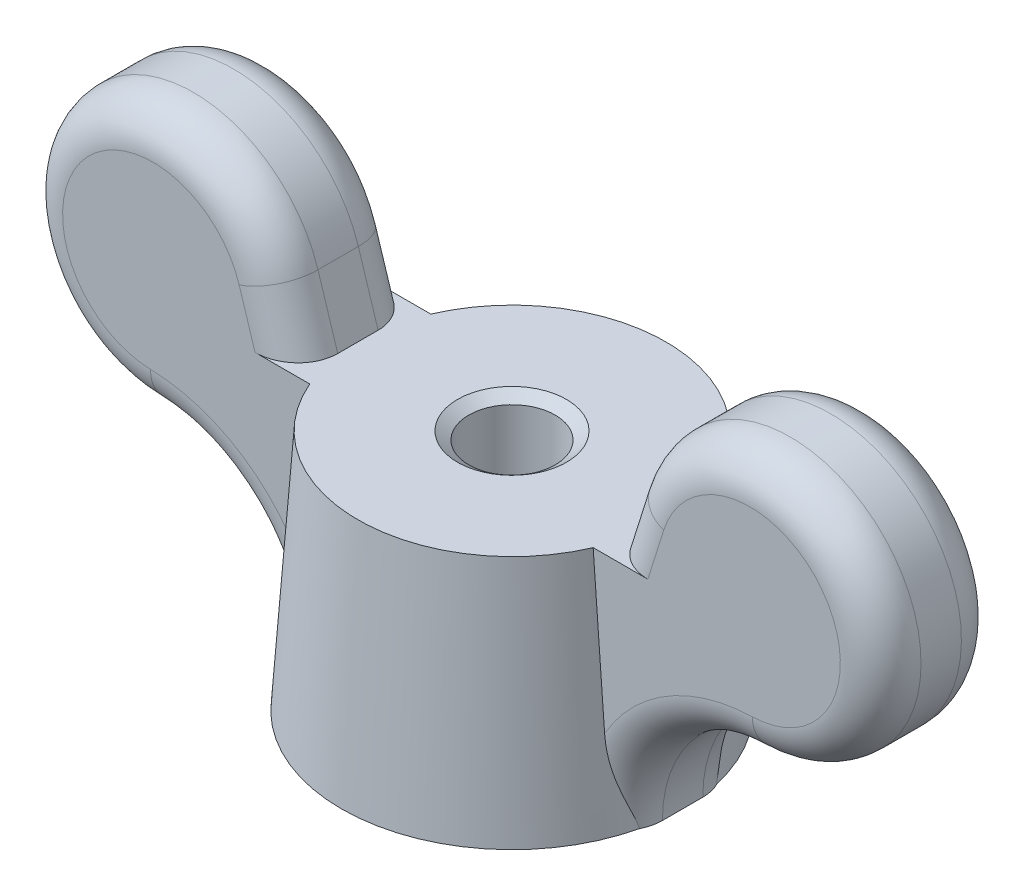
SolidWorks part; units mm, degrees
ref_plane "Front Plane" through (0, 0, 0) normal (0, 0, 1) x (1, 0, 0)
ref_plane "Top Plane" through (0, 0, 0) normal (0, 1, 0) x (1, 0, 0)
ref_plane "Right Plane" through (0, 0, 0) normal (1, 0, 0) x (0, 0, -1)
sketch "WingSke" plane through (0, 0, 0) normal (0, 0, 1) x (1, 0, 0)
  line L0 (-98.8178, 0) -> (98.8178, 0) construction
  line L1 (4.3307, 0) -> (-4.3307, 0) construction
  line L2 (0, 62.7504) -> (0, -62.7504) construction
  line L3 (-3.556, 5.588) -> (3.556, 5.588)
  line L4 (3.556, 5.588) -> (4.012, 7.0344)
  line L7 (3.937, 0) -> (-3.937, 0)
  line L10 (-4.012, 7.0344) -> (-3.556, 5.588)
  arc A0 (4.012, 7.0344) -> (6.9681, 3.1114) centre (6.8892, 6.1272) cw
  arc A5 (-6.9681, 3.1114) -> (-4.012, 7.0344) centre (-6.8892, 6.1272) cw
  circle A6 centre (0, 0) radius 3.937 construction
  arc A7 (3.937, 0) -> (6.9681, 3.1114) centre (7.0495, 0) cw
  arc A8 (-3.937, 0) -> (-6.9681, 3.1114) centre (-7.0495, 0) ccw
  point P29 (0, 0)
extrude "Wing" add sketch "WingSke" along normal mid plane 2.794
sketch "BossSke" plane through (0, 0, 0) normal (0, 0, 1) x (1, 0, 0)
  line L0 (-3.556, 5.588) -> (-3.937, 0)
  line L1 (3.556, 5.588) -> (-3.556, 5.588) construction
  line L2 (4.3307, 0) -> (-4.3307, 0) construction
  line L3 (-3.937, 0) -> (0, 0)
  line L4 (0, 0) -> (0, 5.588)
  line L5 (0, 5.588) -> (-3.556, 5.588)
revolve "Boss" add sketch "BossSke" angle 360 about L4
sketch "BossHoleSke" plane through (0, 0, 0) normal (0, 0, 1) x (1, 0, 0)
  line L0 (0, 5.588) -> (0, 0)
  line L1 (3.2701, 5.588) -> (-3.2701, 5.588) construction
  line L2 (0, 0) -> (0.9969, 0)
  line L3 (4.3307, 0) -> (-4.3307, 0) construction
  line L5 (0.9969, 0) -> (0.9969, 5.588)
  line L7 (0.9969, 5.588) -> (0, 5.588)
  line L8 (0, 5.588) -> (0, 11.176) construction
revolve "BossHole" cut sketch "BossHoleSke" angle 360 about L8
sketch "Sketch7" plane through (0, 0, 0) normal (0, 0, 1) x (1, 0, 0)
  line L0 (0.997, 5.4057) -> (1.2573, 5.588)
  line L1 (0.9969, 0) -> (0.9969, 5.588) construction
  line L2 (3.2701, 5.588) -> (-3.2701, 5.588) construction
  line L5 (0.9969, 5.588) -> (0.997, 5.4057)
  line L6 (0.997, 0.1823) -> (0.997, 0)
  line L7 (0.997, 0) -> (1.2573, 0)
  line L8 (-3.6808, 0) -> (3.6808, 0) construction
  line L9 (1.2573, 0) -> (0.997, 0.1823)
  line L10 (0.9969, 5.588) -> (1.2573, 5.588)
revolve "Cut-Revolve2" cut sketch "Sketch7" angle 360 about L2
fillet "WingFillet" radius 0.9313 12 edges at (9.2985, 7.9427, -1.397) (-9.2985, 7.9427, -1.397) (9.2985, 7.9427, 1.397) (-9.2985, 7.9427, 1.397) (3.784, 6.3112, -1.397) (-3.784, 6.3112, -1.397) (3.784, 6.3112, 1.397) (-3.784, 6.3112, 1.397) (4.82, 2.1719, -1.397) (-4.82, 2.1719, -1.397) (4.82, 2.1719, 1.397) (-4.82, 2.1719, 1.397)
sketch "ThdSchSke" plane through (0, 0, 0) normal (0, 0, 1) x (1, 0, 0)
  line L0 (0, 0) -> (0, 5.588) construction
  line L1 (3.2701, 5.588) -> (-3.2701, 5.588) construction
  line L2 (-0.4985, 5.7449) -> (-0.4985, 5.3803)
  line L3 (-0.4985, 5.3803) -> (-0.9969, 5.3803)
  line L4 (-0.9969, 5.3803) -> (-1.2573, 5.5626)
  line L5 (-1.2573, 5.5626) -> (-0.9969, 5.7449)
  line L6 (-0.9969, 5.7449) -> (-0.4985, 5.7449)
  line L7 (0, 5.0343) -> (2.1821, 5.0343) construction
revolve "ThreadSchematic" [suppressed] cut sketch "ThdSchSke" angle 360 about L0
pattern_linear "ThdSchPat" [suppressed]
equation "\"D1@WingFillet\"=\"WingThicknessC@Wing\"/3"
equation "\"Tap_drill@ThdSchSke\" = \"Thread_min@BossHoleSke\""
equation "\"Thread_major@ThdSchSke\" = \"Thread_Major@ThreadCosmetic\""
equation "\"D1@ThdSchSke\" = \"Tap_drill@ThdSchSke\" * 0.5"
equation "\"Advance@ThdSchPat\" =  ( \"BossHeightG@WingSke\" - 0.002 )  /  ( \"Num_Threads@ThdSchPat\" - 1 ) 'relax it"
equation "\"Num_Threads@ThdSchPat\"=int(  (\"BossHeightG@WingSke\" - 0.002 ) / \"Advance@ThdSchSke\" + 0.999 )  + 1"
equation "\"D3@Sketch7\" = \"Thread_Major@ThreadCosmetic\" * 0.5"
